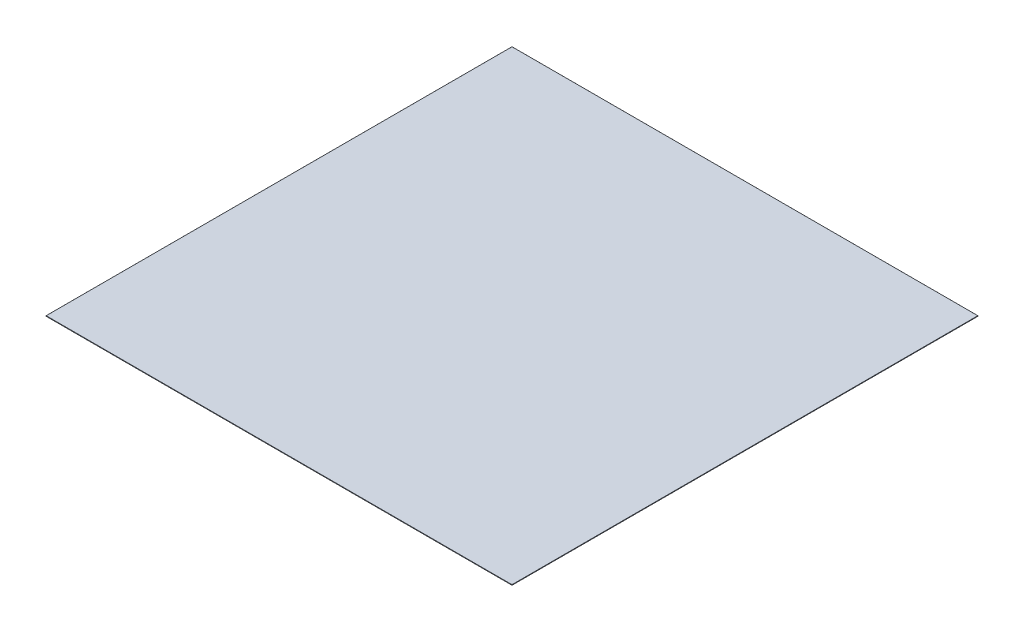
SolidWorks part; units mm, degrees
ref_plane "Ebene vorne" through (0, 0, 0) normal (0, 0, 1) x (1, 0, 0)
ref_plane "Ebene oben" through (0, 0, 0) normal (0, 1, 0) x (1, 0, 0)
ref_plane "Ebene rechts" through (0, 0, 0) normal (1, 0, 0) x (0, 0, -1)
sketch "Skizze1" plane through (0, 0, 0) normal (0, 1, 0) x (1, 0, 0)
  line L0 (0, 0) -> (45, 0) construction
  line L1 (-45, -45) -> (45, -45)
  line L2 (-45, -45) -> (-45, 45)
  line L3 (-45, 45) -> (45, 45)
  line L4 (45, -45) -> (45, 45)
  line L5 (0, 0) -> (0, 45) construction
  dimension "D1" = 90
  dimension "D2" = 90
extrude "Aufsatz-Linear austragen1" add sketch "Skizze1" along normal mid plane 0.1
fillet "Verrundung1" radius 0.02 8 edges at (0, -0.05, 45) (45, -0.05, 0) (0, -0.05, -45) (-45, -0.05, 0) (0, 0.05, -45) (45, 0.05, 0) (0, 0.05, 45) (-45, 0.05, 0)
